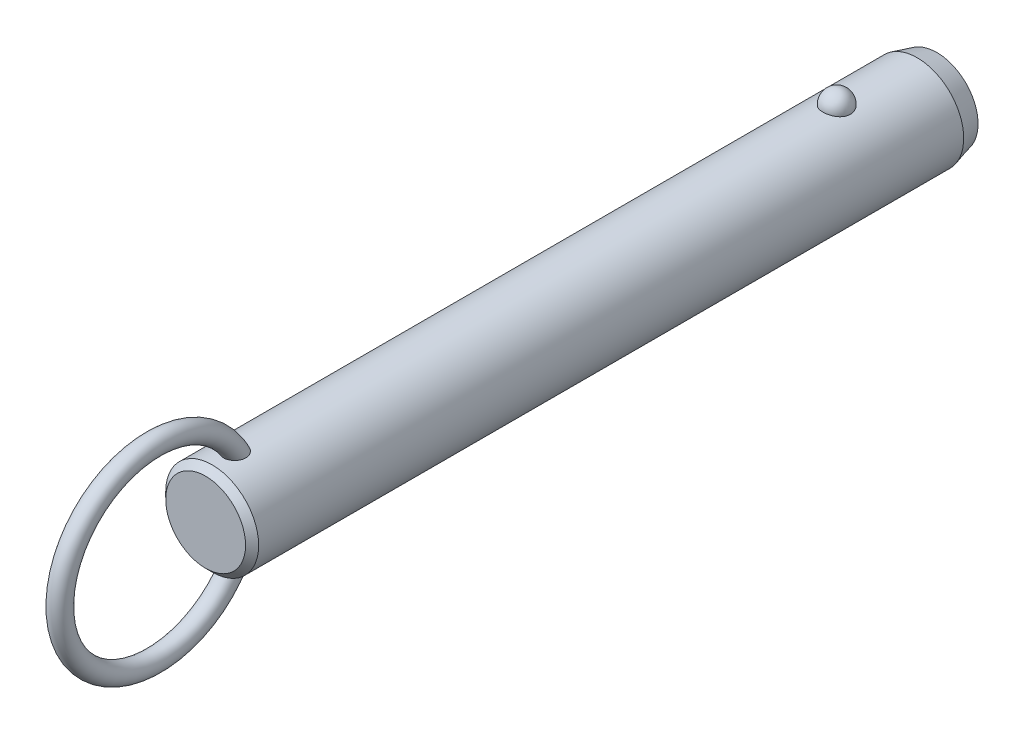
SolidWorks part; units mm, degrees
ref_plane "Front Plane" through (0, 0, 0) normal (0, 0, 1) x (1, 0, 0)
ref_plane "Top Plane" through (0, 0, 0) normal (0, 1, 0) x (1, 0, 0)
ref_plane "Right Plane" through (0, 0, 0) normal (1, 0, 0) x (0, 0, -1)
sketch "Sketch2" plane through (0, 0, 0) normal (0, 0, 1) x (1, 0, 0)
  circle A0 centre (0, 0) radius 7.1
  point P3 (0, 7.1)
  dimension "D1" = 14.2
extrude "Boss-Extrude1" add sketch "Sketch2" along normal blind 86.4
sketch "Sketch3" plane through (0, 0, 0) normal (0, 0, -1) x (-1, 0, 0)
  circle A0 centre (0, 0) radius 7.1
  dimension "D1" = 14.2
extrude "Boss-Extrude2" add sketch "Sketch3" along normal blind 17.4
chamfer "Chamfer1" distance 3 angle 15 1 edges at (-7.1, 0, -17.4)
sketch "Sketch12" plane through (0, 0, 0) normal (1, 0, 0) x (0, 0, -1)
  line L0 (-86.4, 7.1) -> (-86.4, -7.1) construction
  point P0 (-86.4, 0)
sketch "Sketch13" plane through (0, 0, 0) normal (1, 0, 0) x (0, 0, -1)
  circle A0 centre (-102.25, 0) radius 15.85
  point P2 (-86.4, 0)
  dimension "D1" = 31.7
sketch "Sketch14" plane through (0, 0, 0) normal (0, 1, 0) x (1, 0, 0)
  circle A0 centre (0, -87.9) radius 1.5
  point P2 (0, -86.4)
  dimension "D1" = 3
sweep "Sweep1" add profiles "Sketch14" path "Sketch13"
sketch "Sketch15" plane through (0, 0, 86.4) normal (0, 0, 1) x (1, 0, 0)
  circle A0 centre (0, 0) radius 7.1
  dimension "D1" = 14.2
extrude "Boss-Extrude3" add sketch "Sketch15" along normal blind 7.92
chamfer "Chamfer2" distance 1 angle 45 1 edges at (7.1, 0, 94.32)
sketch "Sketch18" plane through (0, 0, 0) normal (1, 0, 0) x (0, 0, -1)
  line L0 (14.4, 7.1) -> (-88.0792, 7.1) construction
  line L1 (2.1, 9.2) -> (2.1, 5)
  line L2 (-88.0792, -7.1) -> (14.4, -7.1) construction
  arc A0 (2.1, 9.2) -> (2.1, 5) centre (2.1, 7.1) ccw
  point P4 (0, 7.1)
  dimension "D1" = 16.3
revolve "Revolve1" add sketch "Sketch18" angle 360 about L1
